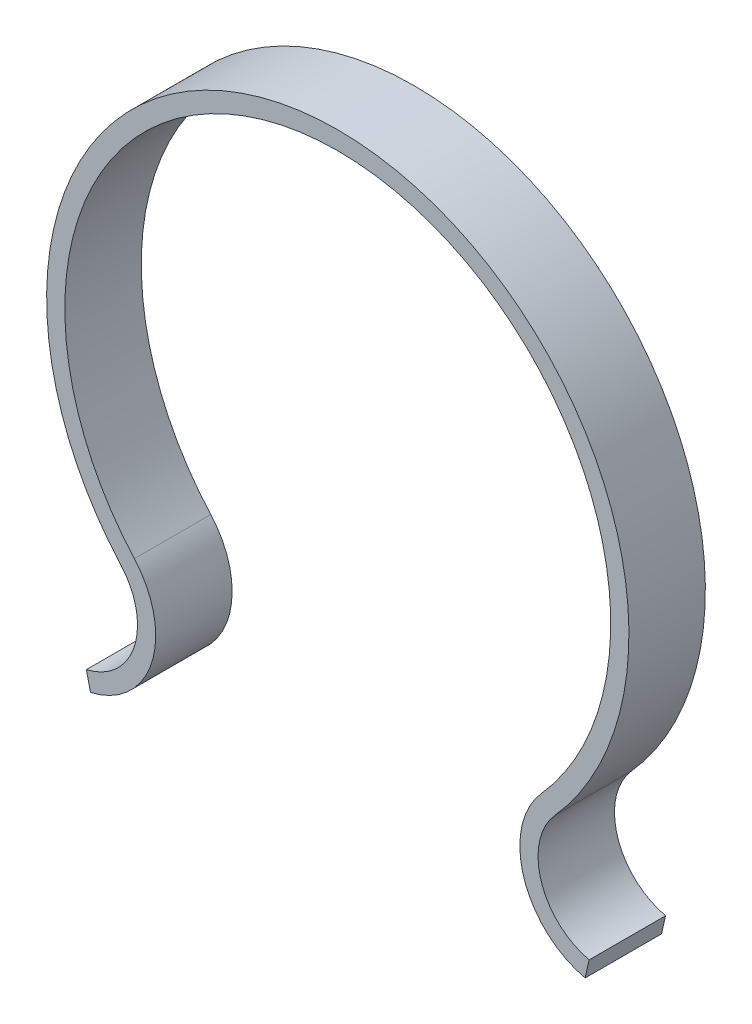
SolidWorks part; units mm, degrees
ref_plane "Front Plane" through (0, 0, 0) normal (0, 0, 1) x (1, 0, 0)
ref_plane "Top Plane" through (0, 0, 0) normal (0, 1, 0) x (1, 0, 0)
ref_plane "Right Plane" through (0, 0, 0) normal (1, 0, 0) x (0, 0, -1)
sketch "Sketch1" plane through (0, 0, 0) normal (0, 0, 1) x (1, 0, 0)
  line L0 (0, 0) -> (0, -6.9459) construction
  arc A0 (-5.9626, -5.3336) -> (5.9626, -5.3336) centre (0, 0) cw
  arc A1 (-5.9626, -5.3336) -> (-6.907, -8.2985) centre (-7.3086, -6.5377) cw
  arc A4 (5.9626, -5.3336) -> (6.907, -8.2985) centre (7.3086, -6.5377) ccw
  dimension "D1" = 8
extrude "Extrude-Thin1" add sketch "Sketch1" along normal blind 2.1 thin
